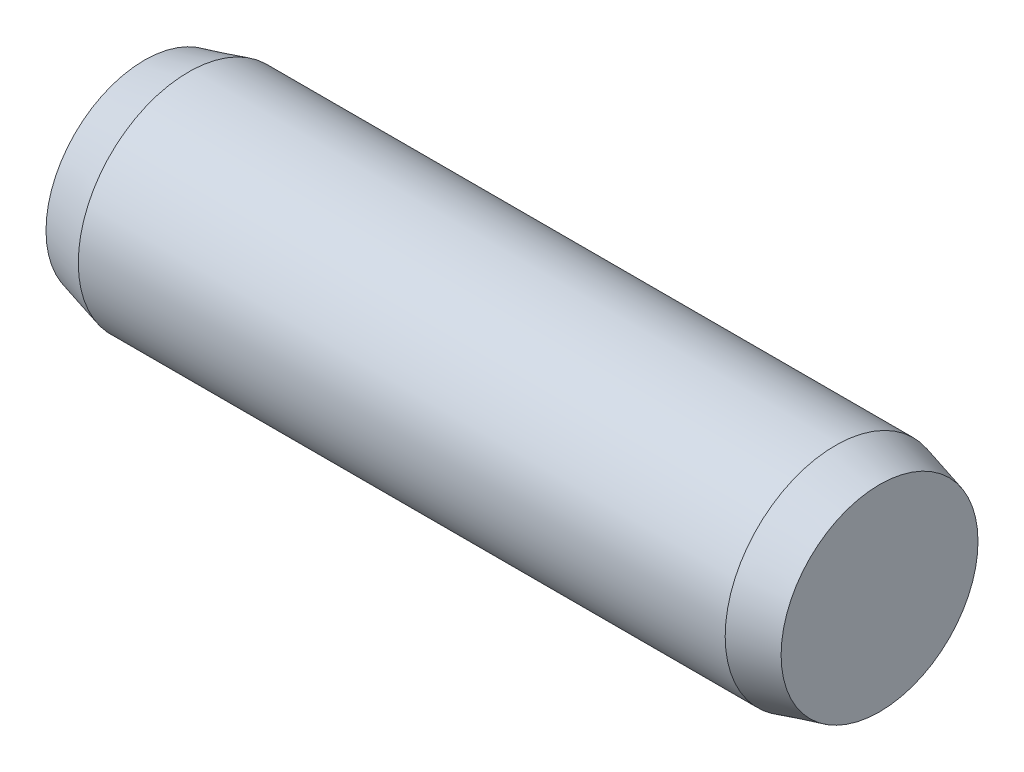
SolidWorks part; units mm, degrees
ref_plane "Front" through (0, 0, 0) normal (0, 0, 1) x (1, 0, 0)
ref_plane "Top" through (0, 0, 0) normal (0, 1, 0) x (1, 0, 0)
ref_plane "Right" through (0, 0, 0) normal (1, 0, 0) x (0, 0, -1)
sketch "Sketch1" plane through (0, 0, 0) normal (0, 0, 1) x (1, 0, 0)
  line L0 (0, 0) -> (20, 0)
  line L1 (20, 0) -> (20, 2.6785)
  line L2 (20, 2.6785) -> (18.8, 3)
  line L3 (18.8, 3) -> (1.2, 3)
  line L4 (1.2, 3) -> (0, 2.6785)
  line L5 (0, 2.6785) -> (0, 0)
  line L6 (-1.6557, 0) -> (2.6973, 0) construction
  dimension "l" = 20
  dimension "D2" = 15
  dimension "D3" = 15
  dimension "d" = 6
  dimension "c" = 1.2
  dimension "D6" = 1.2
revolve "Base-Revolve" add sketch "Sketch1" angle 360 about L6
equation "\"D6@Sketch1\" = \"c@Sketch1\""
